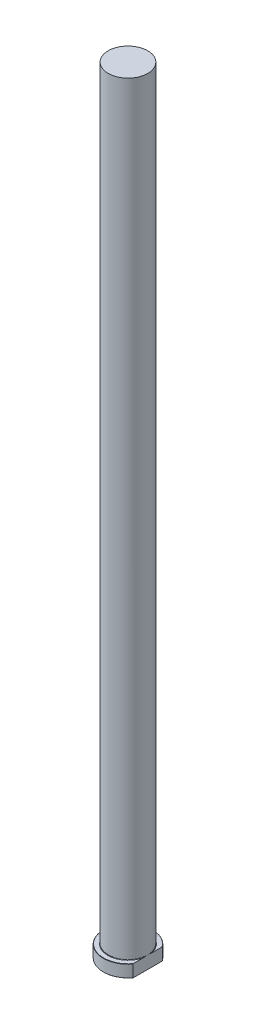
SolidWorks part; units mm, degrees
ref_plane "Front Plane" through (0, 0, 0) normal (0, 0, 1) x (1, 0, 0)
ref_plane "Top Plane" through (0, 0, 0) normal (0, 1, 0) x (1, 0, 0)
ref_plane "Right Plane" through (0, 0, 0) normal (1, 0, 0) x (0, 0, -1)
sketch "Sketch1" plane through (0, 0, 0) normal (0, 0, 1) x (1, 0, 0)
  line L0 (0, 259.9588) -> (0, -15.1925) construction
  line L1 (0, 0) -> (-20, 0)
  line L2 (-20, 0) -> (-20, 10)
  line L3 (-20, 10) -> (-16, 10)
  line L4 (-16, 10) -> (-16, 630)
  line L5 (-16, 630) -> (0, 630)
  line L6 (0, 630) -> (0, 0)
  dimension "L" = 630
  dimension "H" = 40
  dimension "T" = 10
  dimension "D" = 32
revolve "Revolve1" add sketch "Sketch1" angle 360 about L0
chamfer "Chamfer1" distance 0.2 angle 45 2 edges at (0, 10, 20) (0, 0, 20)
fillet "Fillet1" radius 0.3 1 edges at (0, 10, 16)
sketch "Sketch2" plane through (0, 0, 0) normal (0, 1, 0) x (1, 0, 0)
  line L0 (16, 12) -> (16, -12)
  circle A0 centre (0, 0) radius 20 construction
  arc A1 (16, -12) -> (16, 12) centre (0, 0) ccw
  circle A2 centre (0, 0) radius 16 construction
extrude "KEY" cut sketch "Sketch2" along normal through all
